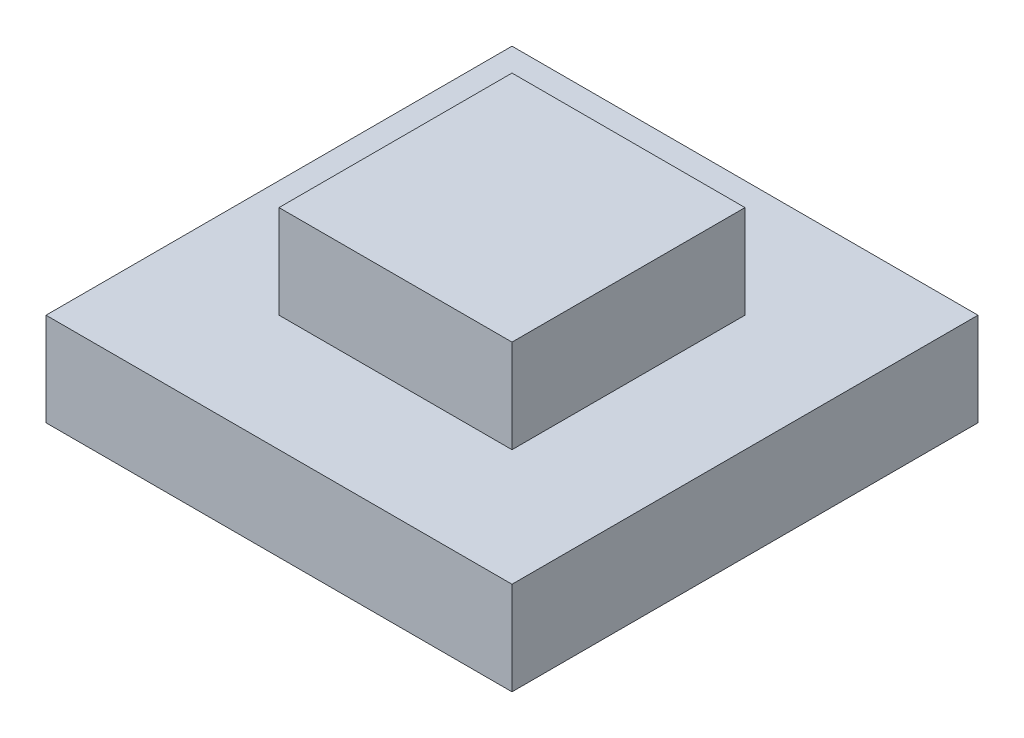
SolidWorks part; units mm, degrees
ref_plane "Front Plane" through (0, 0, 0) normal (0, 0, 1) x (1, 0, 0)
ref_plane "Top Plane" through (0, 0, 0) normal (0, 1, 0) x (1, 0, 0)
ref_plane "Right Plane" through (0, 0, 0) normal (1, 0, 0) x (0, 0, -1)
sketch "Sketch1" plane through (0, 0, 0) normal (0, 1, 0) x (1, 0, 0)
  line L1 (50, -50) -> (-50, -50)
  line L2 (50, -50) -> (50, 50)
  line L3 (50, 50) -> (-50, 50)
  line L4 (-50, -50) -> (-50, 50)
  line L5 (50, -50) -> (-50, 50) construction
  line L6 (50, 50) -> (-50, -50) construction
  point P0 (0, 0)
  dimension "D1" = 100
extrude "Boss-Extrude1" add sketch "Sketch1" along normal blind 20
sketch "Sketch2" plane through (0, 20, 0) normal (0, 1, 0) x (1, 0, 0)
  line L1 (25, -25) -> (-25, -25)
  line L2 (25, -25) -> (25, 25)
  line L3 (25, 25) -> (-25, 25)
  line L4 (-25, -25) -> (-25, 25)
  line L5 (25, -25) -> (-25, 25) construction
  line L6 (25, 25) -> (-25, -25) construction
  point P0 (0, 0)
  dimension "D1" = 50
extrude "Boss-Extrude2" add sketch "Sketch2" along normal blind 20 separate body
ref_plane "Plane1" through (70, 0, 0) normal (1, 0, 0) x (0, 0, -1)
